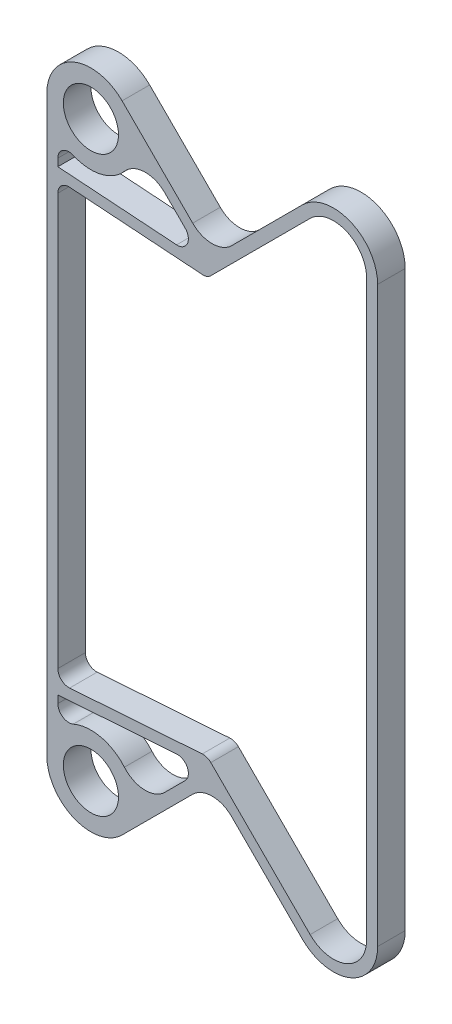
SolidWorks part; units mm, degrees
ref_plane "Plan de face" through (0, 0, 0) normal (0, 0, 1) x (1, 0, 0)
ref_plane "Plan de dessus" through (0, 0, 0) normal (0, 1, 0) x (1, 0, 0)
ref_plane "Plan de droite" through (0, 0, 0) normal (1, 0, 0) x (0, 0, -1)
sketch "Esquisse1" plane through (0, 0, 0) normal (0, 0, 1) x (1, 0, 0)
  line L1 (299.9672, -522.2904) -> (299.9672, 522.2904)
  line L4 (299.9672, -600) -> (407.2449, -600) construction
  line L5 (819.9344, -520) -> (379.9344, -520) construction
  line L6 (564.5791, -448.4924) -> (436.503, -576.5685)
  line L8 (763.3659, -576.5685) -> (635.2897, -448.4924)
  line L9 (550.8637, -433.9235) -> (514.0123, -470.7749)
  line L10 (777.508, -562.4264) -> (597.4334, -382.3518)
  line L11 (319.9672, -414.8094) -> (535.3338, -399.8296)
  line L14 (341.355, -393.2735) -> (581.9035, -376.5421)
  line L15 (319.9672, -414.8094) -> (319.9672, -428.3342)
  line L22 (418.8306, 0) -> (299.9672, 0) construction
  line L27 (299.9672, 0) -> (299.9672, 863.3972) construction
  line L28 (819.9344, 520) -> (379.9344, 520) construction
  line L29 (599.9344, 0) -> (599.9344, 745.5661) construction
  line L31 (319.9672, 414.8094) -> (319.9672, 428.3342)
  line L32 (341.355, 393.2735) -> (581.9035, 376.5421)
  line L33 (319.9672, 414.8094) -> (535.3338, 399.8296)
  line L34 (879.9344, 520) -> (879.9344, -520)
  line L35 (319.9672, -373.3217) -> (319.9672, 373.3217)
  line L36 (777.508, 562.4264) -> (597.4334, 382.3518)
  line L37 (550.8637, 433.9235) -> (514.0123, 470.7749)
  line L38 (763.3659, 576.5685) -> (635.2897, 448.4924)
  line L39 (564.5791, 448.4924) -> (436.503, 576.5685)
  line L40 (899.9344, 520) -> (899.9344, -520)
  line L41 (299.9672, 600) -> (407.2449, 600) construction
  arc A6 (299.9672, 517.7096) -> (299.9672, 522.2904) centre (220, 520) ccw
  arc A8 (299.9672, -522.2904) -> (379.9344, -600) centre (379.9344, -520) ccw
  arc A12 (299.9672, 517.7096) -> (299.9672, 522.2904) centre (220, 520) ccw
  arc A14 (299.9672, 517.7096) -> (299.9672, 522.2904) centre (220, 520) ccw
  arc A19 (819.9344, -600) -> (899.9344, -520) centre (819.9344, -520) ccw
  circle A20 centre (379.9344, -520) radius 50
  arc A21 (597.4334, 382.3518) -> (581.9035, 376.5421) centre (583.2913, 396.4939) cw
  arc A22 (319.9672, 373.3217) -> (341.355, 393.2735) centre (339.9672, 373.3217) cw
  arc A23 (319.9672, 428.3342) -> (347.9606, 446.6673) centre (339.9672, 428.3342) cw
  arc A24 (535.3338, 399.8296) -> (550.8637, 433.9235) centre (536.7215, 419.7814) ccw
  arc A25 (440.6868, 467.9505) -> (514.0123, 470.7749) centre (478.657, 435.4196) cw
  arc A26 (440.6868, 467.9505) -> (347.9606, 446.6673) centre (379.9344, 520) cw
  arc A27 (299.9672, 517.7096) -> (436.503, 576.5685) centre (379.9344, 520) cw
  arc A28 (440.6868, 467.9505) -> (374.3834, 440.1928) centre (379.9344, 520) cw
  arc A29 (299.9672, 517.7096) -> (436.503, 576.5685) centre (379.9344, 520) cw
  arc A30 (459.7774, 525.0098) -> (459.9344, 520) centre (379.9344, 520) cw
  arc A31 (777.508, 562.4264) -> (879.9344, 520) centre (819.9344, 520) cw
  arc A32 (459.7774, 525.0098) -> (459.9344, 520) centre (379.9344, 520) cw
  arc A33 (564.5791, 448.4924) -> (635.2897, 448.4924) centre (599.9344, 483.8478) ccw
  arc A34 (763.3659, 576.5685) -> (899.9344, 520) centre (819.9344, 520) cw
  arc A35 (299.9672, 517.7096) -> (436.503, 576.5685) centre (379.9344, 520) cw
  circle A36 centre (379.9344, 520) radius 50
  arc A37 (819.9344, 600) -> (899.9344, 520) centre (819.9344, 520) cw
  arc A38 (299.9672, 522.2904) -> (379.9344, 600) centre (379.9344, 520) cw
  arc A39 (299.9672, -517.7096) -> (436.503, -576.5685) centre (379.9344, -520) ccw
  arc A40 (763.3659, -576.5685) -> (899.9344, -520) centre (819.9344, -520) ccw
  arc A41 (564.5791, -448.4924) -> (635.2897, -448.4924) centre (599.9344, -483.8478) cw
  arc A42 (459.7774, -525.0098) -> (459.9344, -520) centre (379.9344, -520) ccw
  arc A43 (777.508, -562.4264) -> (879.9344, -520) centre (819.9344, -520) ccw
  arc A44 (459.7774, -525.0098) -> (459.9344, -520) centre (379.9344, -520) ccw
  arc A45 (299.9672, -517.7096) -> (436.503, -576.5685) centre (379.9344, -520) ccw
  arc A46 (440.6868, -467.9505) -> (374.3834, -440.1928) centre (379.9344, -520) ccw
  arc A47 (299.9672, -517.7096) -> (436.503, -576.5685) centre (379.9344, -520) ccw
  arc A48 (440.6868, -467.9505) -> (347.9606, -446.6673) centre (379.9344, -520) ccw
  arc A49 (440.6868, -467.9505) -> (514.0123, -470.7749) centre (478.657, -435.4196) ccw
  arc A50 (535.3338, -399.8296) -> (550.8637, -433.9235) centre (536.7215, -419.7814) cw
  arc A51 (319.9672, -428.3342) -> (347.9606, -446.6673) centre (339.9672, -428.3342) ccw
  arc A52 (319.9672, -373.3217) -> (341.355, -393.2735) centre (339.9672, -373.3217) ccw
  arc A53 (597.4334, -382.3518) -> (581.9035, -376.5421) centre (583.2913, -396.4939) ccw
  arc A54 (299.9672, -517.7096) -> (299.9672, -522.2904) centre (220, -520) cw
  arc A55 (299.9672, -517.7096) -> (299.9672, -522.2904) centre (220, -520) cw
  arc A56 (299.9672, -517.7096) -> (299.9672, -522.2904) centre (220, -520) cw
  point P5 (299.9672, -500.5004)
  point P16 (279.9672, 414.8094)
  point P19 (281.355, 394.8576)
  point P21 (77.9713, 392.1134)
  point P29 (49.4975, 434.3503)
  point P30 (177.5736, 562.4264)
  point P33 (-9.8017, 394.6546)
  point P34 (279.9672, -500.5004)
  point P35 (279.9672, 522.2904)
  point P40 (-8.414, 374.7028)
  point P43 (175.5124, 489.6545)
extrude "Boss.-Extru.1" add sketch "Esquisse1" along normal blind 50
mirror "Symétrie1" about plane through (0, 0, 0) normal (0, 1, 0)
ref_plane "Plan1" through (299.9672, 0, 0) normal (-1, 0, 0) x (0, 0, 1)
